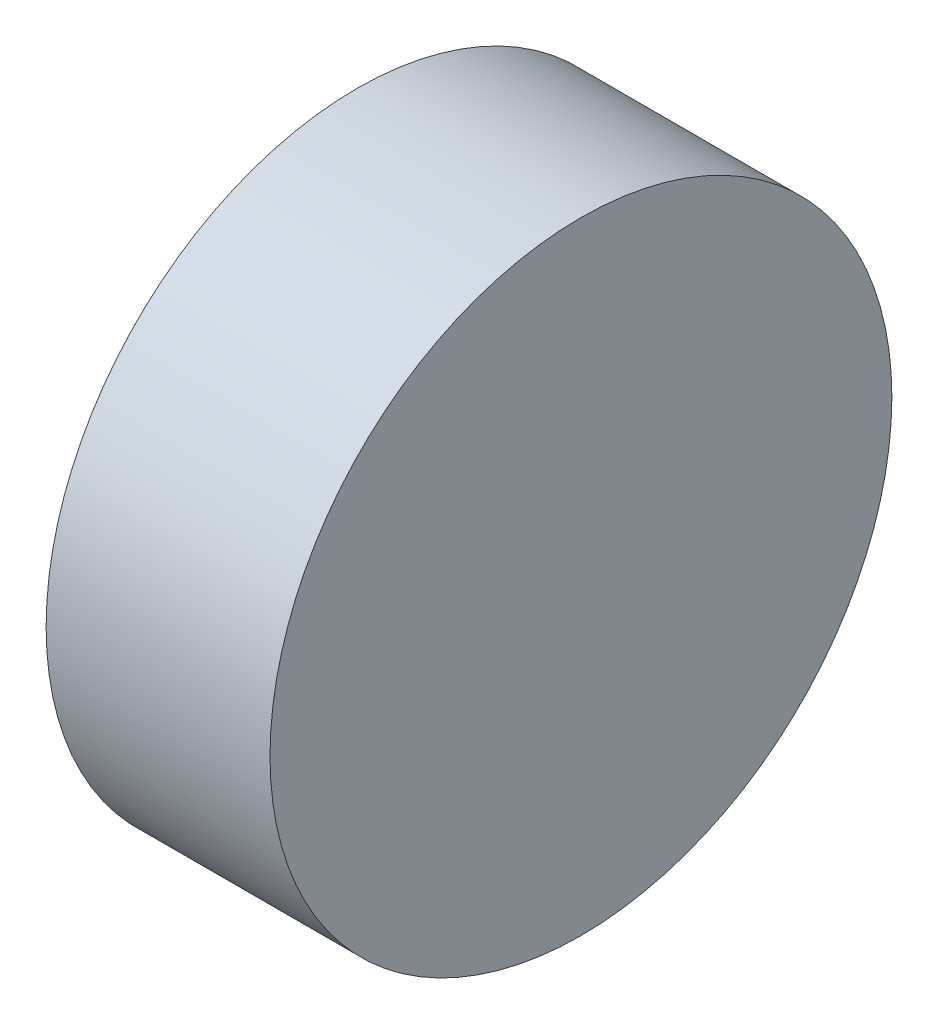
SolidWorks part; units mm, degrees
ref_plane "Plan de face" through (0, 0, 0) normal (0, 0, 1) x (1, 0, 0)
ref_plane "Plan de dessus" through (0, 0, 0) normal (0, 1, 0) x (1, 0, 0)
ref_plane "Plan de droite" through (0, 0, 0) normal (1, 0, 0) x (0, 0, -1)
sketch "Esquisse1" plane through (0, 0, 0) normal (0, 0, 1) x (1, 0, 0)
  line L0 (0, 0) -> (89.9204, 0) construction
  line L1 (0, 0) -> (0, 37.5)
  line L2 (0, 37.5) -> (27, 37.5)
  line L3 (0, 0) -> (27, 0)
  line L7 (27, 37.5) -> (27, 0)
  dimension "D1" = 75
  dimension "D2" = 27
revolve "Révolution1" add sketch "Esquisse1" angle 360 about L0
